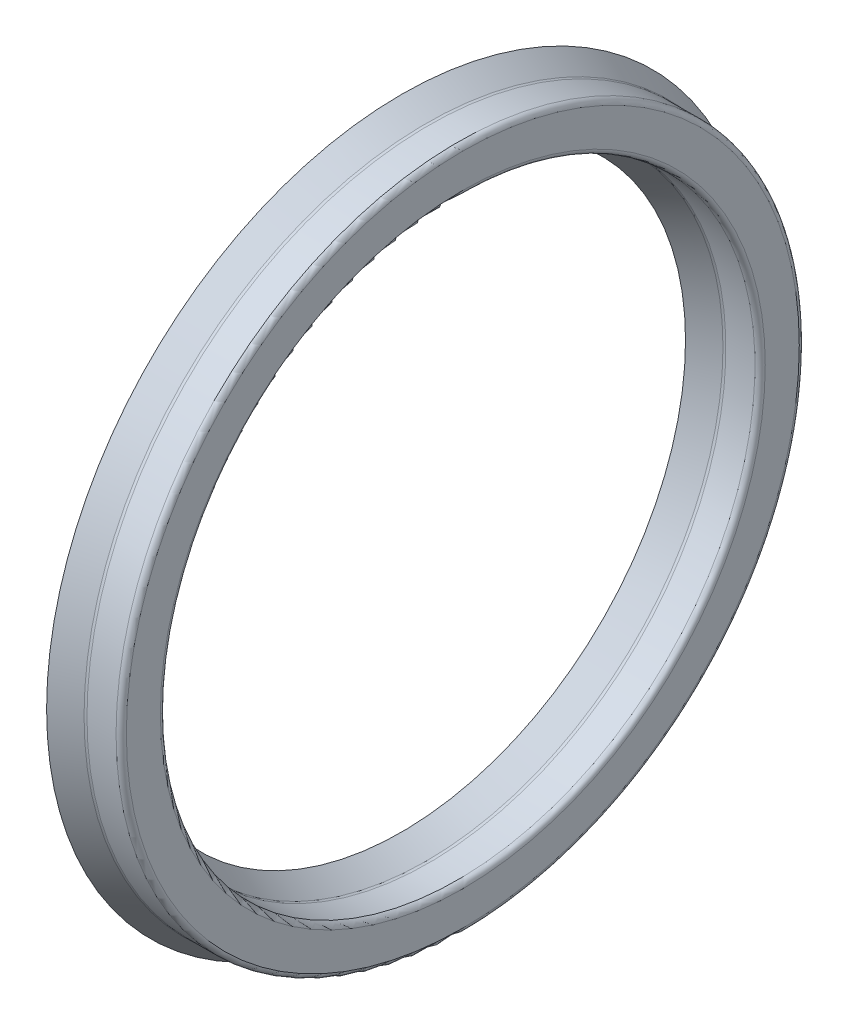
SolidWorks part; units mm, degrees
ref_plane "Front Plane" through (0, 0, 0) normal (0, 0, 1) x (1, 0, 0)
ref_plane "Top Plane" through (0, 0, 0) normal (0, 1, 0) x (1, 0, 0)
ref_plane "Right Plane" through (0, 0, 0) normal (1, 0, 0) x (0, 0, -1)
sketch "Sketch2" plane through (0, 0, 0) normal (0, 0, 1) x (1, 0, 0)
  line L0 (69.1667, 333) -> (345.8333, 333) construction
sketch "Sketch3" plane through (0, 0, 0) normal (0, 0, 1) x (1, 0, 0)
  line L0 (-1.7344, 23.8125) -> (-0.0795, 22.9557)
  line L1 (0.079, 22.9171) -> (2.0302, 22.9171)
  line L2 (2.3749, 22.5724) -> (2.3749, 20.2901)
  line L3 (2.0302, 19.9454) -> (0.079, 19.9454)
  line L4 (-0.0795, 19.9068) -> (-1.7344, 19.05)
  line L5 (-1.7344, 19.05) -> (-2.3749, 20.2871)
  line L6 (-2.3749, 20.2871) -> (-0.7562, 21.1251)
  line L7 (-0.7562, 21.7374) -> (-2.3749, 22.5754)
  line L8 (-2.3749, 22.5754) -> (-1.7344, 23.8125)
  line L9 (-2.3749, 0) -> (2.3749, 0) construction
  line L10 (-2.3749, 22.5754) -> (-2.3749, 20.2871) construction
  line L11 (-2.3749, 21.4312) -> (2.3749, 21.4312) construction
  line L13 (-1.7344, 23.8125) -> (-1.7344, 19.05) construction
  line L14 (1.0546, 22.9171) -> (1.0546, 19.9454) construction
  arc A0 (0.079, 19.9454) -> (-0.0795, 19.9068) centre (0.079, 19.6006) ccw
  arc A1 (-0.0795, 22.9557) -> (0.079, 22.9171) centre (0.079, 23.2619) ccw
  arc A2 (-0.7562, 21.1251) -> (-0.7562, 21.7374) centre (-0.9147, 21.4312) ccw
  arc A3 (2.3749, 20.2901) -> (2.0302, 19.9454) centre (2.0302, 20.2901) cw
  arc A4 (2.0302, 22.9171) -> (2.3749, 22.5724) centre (2.0302, 22.5724) cw
  point P24 (-0.57, 21.4312)
revolve "Revolve1" add sketch "Sketch3" angle 360 about L9
equation "\"D4@Sketch3\"=(\"OD@Sketch3\"-\"ID@Sketch3\")*.312"
equation "\"D3@Sketch3\"=\"D4@Sketch3\"*.77"
equation "\"D2@Sketch3\"=\"Seal Width@Sketch3\"*.62"
equation "\"D1@Sketch3\"=\"D4@Sketch3\"*.116"
